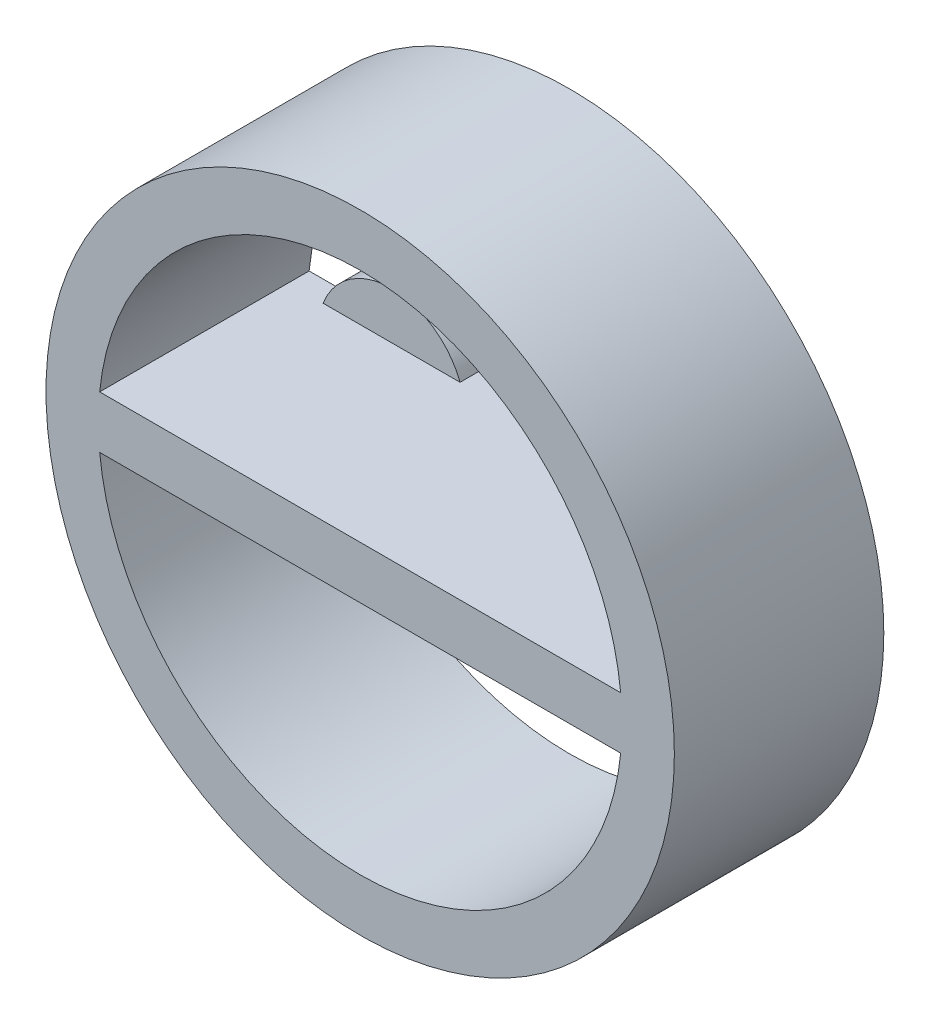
SolidWorks part; units mm, degrees
ref_plane "Plan de face" through (0, 0, 0) normal (0, 0, 1) x (1, 0, 0)
ref_plane "Plan de dessus" through (0, 0, 0) normal (0, 1, 0) x (1, 0, 0)
ref_plane "Plan de droite" through (0, 0, 0) normal (1, 0, 0) x (0, 0, -1)
sketch "Esquisse1" plane through (0, 0, 0) normal (0, 0, 1) x (1, 0, 0)
  circle A0 centre (0, 0) radius 3
  circle A1 centre (0, 0) radius 2.5
extrude "Boss.-Extru.1" add sketch "Esquisse1" along normal blind 2
sketch "Esquisse2" plane through (0, 0, 0) normal (0, 0, 1) x (1, 0, 0)
  line L1 (-2.75, 0.25) -> (2.75, 0.25)
  line L2 (-2.75, 0.25) -> (-2.75, -0.25)
  line L3 (-2.75, -0.25) -> (2.75, -0.25)
  line L4 (2.75, 0.25) -> (2.75, -0.25)
  line L5 (-2.75, 0.25) -> (2.75, -0.25) construction
  line L6 (-2.75, -0.25) -> (2.75, 0.25) construction
  point P0 (0, 0)
  dimension "D1" = 0.5
  dimension "D2" = 5.5
extrude "Boss.-Extru.2" add sketch "Esquisse2" along normal blind 2
sketch "Esquisse3" plane through (0, 0, 0) normal (0, 0, 1) x (1, 0, 0)
  circle A0 centre (1.5, 0) radius 0.7
  dimension "D1" = 1.5
extrude "Boss.-Extru.3" add sketch "Esquisse3" along normal blind 0.2
sketch "Esquisse4" plane through (0, 0, 0) normal (0, 0, 1) x (1, 0, 0)
  circle A0 centre (-1.5, 0) radius 0.7
  dimension "D1" = 1.5
extrude "Boss.-Extru.4" add sketch "Esquisse4" along normal blind 0.2
